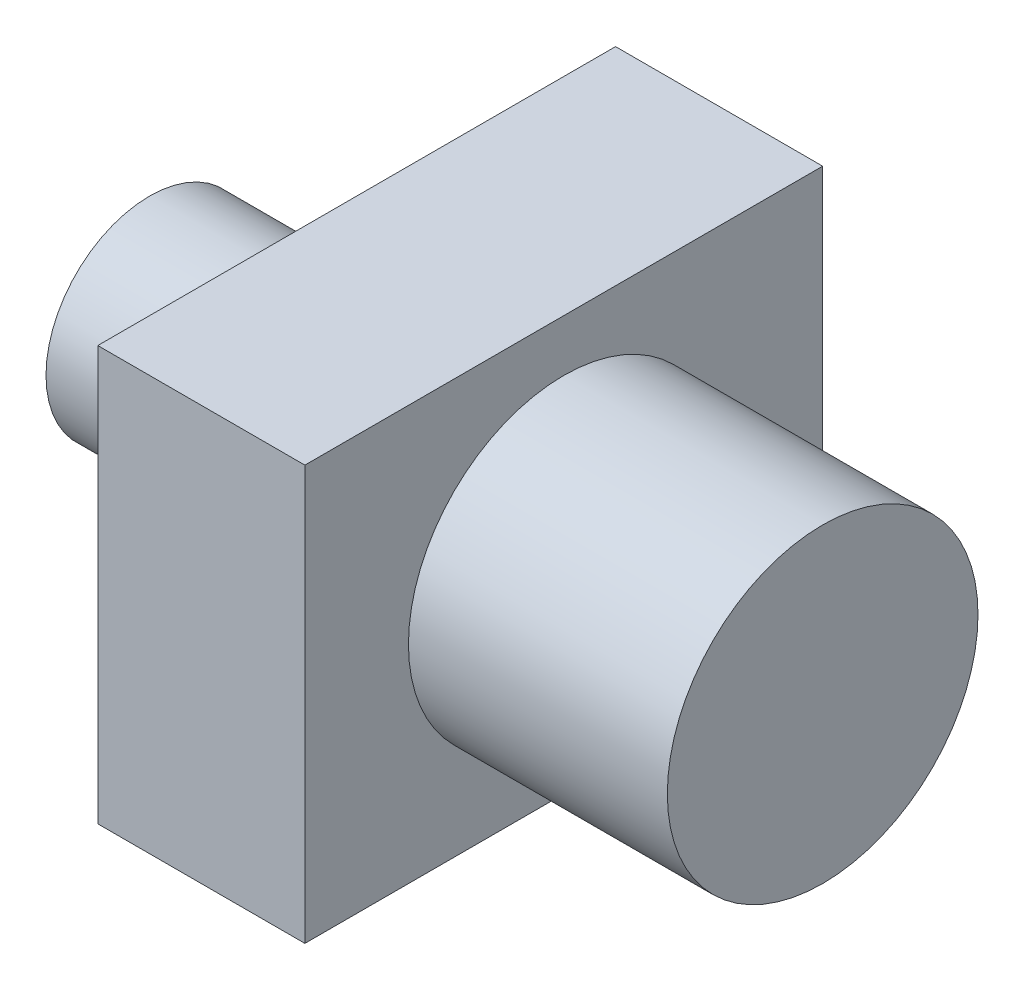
SolidWorks part; units mm, degrees
ref_plane "前视基准面" through (0, 0, 0) normal (0, 0, 1) x (1, 0, 0)
ref_plane "上视基准面" through (0, 0, 0) normal (0, 1, 0) x (1, 0, 0)
ref_plane "右视基准面" through (0, 0, 0) normal (1, 0, 0) x (0, 0, -1)
sketch "草图1" plane through (0, 0, 0) normal (1, 0, 0) x (0, 0, -1)
  line L0 (0, 0) -> (95.1405, 0) construction
  line L1 (-50, 40) -> (50, 40)
  line L2 (-50, 40) -> (-50, -40)
  line L3 (-50, -40) -> (50, -40)
  line L4 (50, 40) -> (50, -40)
  line L5 (95.1405, 0) -> (0, 0) construction
  line L6 (0, 0) -> (0, 71.8572) construction
extrude "拉伸1" add sketch "草图1" along normal blind 40
sketch "草图2" plane through (0, 0, 0) normal (-1, 0, 0) x (0, 0, 1)
  circle A0 centre (0, 0) radius 20
extrude "拉伸2" add sketch "草图2" along normal blind 40
sketch "草图3" plane through (40, 0, 0) normal (1, 0, 0) x (0, 0, -1)
  circle A0 centre (0, 0) radius 30
extrude "拉伸3" add sketch "草图3" along normal blind 50
